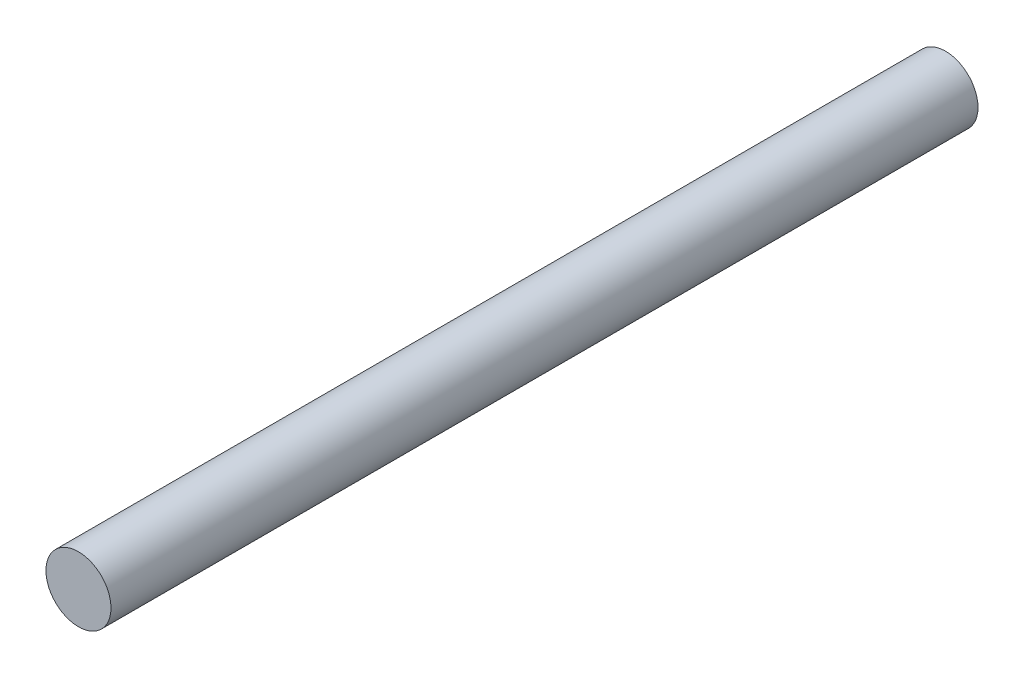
SolidWorks part; units mm, degrees
ref_plane "Plan de face" through (0, 0, 0) normal (0, 0, 1) x (1, 0, 0)
ref_plane "Plan de dessus" through (0, 0, 0) normal (0, 1, 0) x (1, 0, 0)
ref_plane "Plan de droite" through (0, 0, 0) normal (1, 0, 0) x (0, 0, -1)
sketch "Esquisse1" plane through (0, 0, 0) normal (0, 0, 1) x (1, 0, 0)
  circle A0 centre (0, 0) radius 6
  dimension "D1" = 12
extrude "Extrusion1" add sketch "Esquisse1" along normal blind 160
